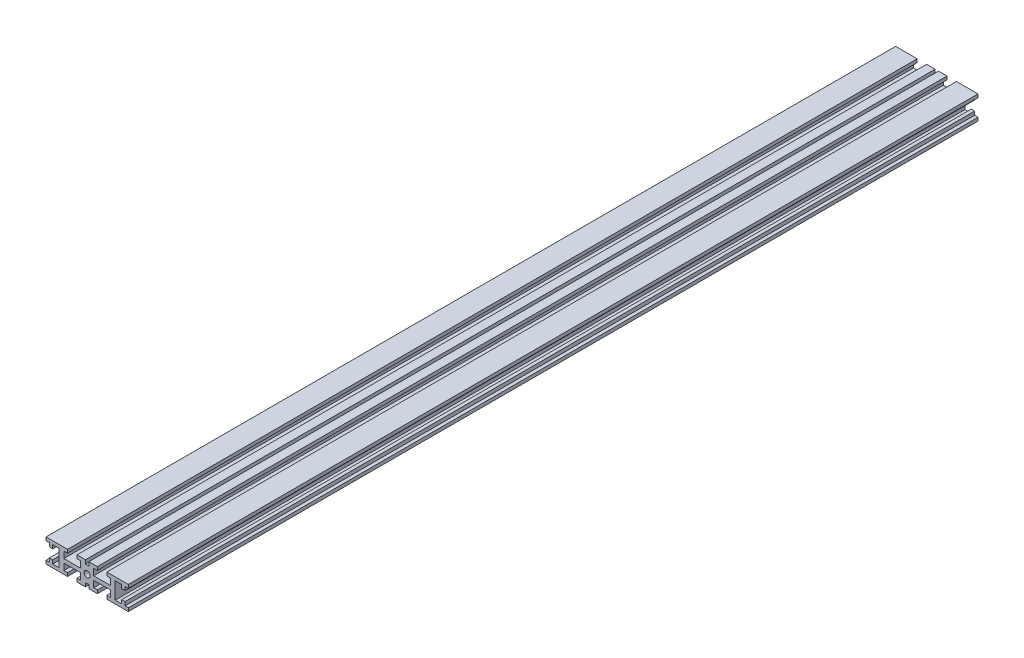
SolidWorks part; units mm, degrees
ref_plane "Front Plane" through (0, 0, 0) normal (0, 0, 1) x (1, 0, 0)
ref_plane "Top Plane" through (0, 0, 0) normal (0, 1, 0) x (1, 0, 0)
ref_plane "Right Plane" through (0, 0, 0) normal (1, 0, 0) x (0, 0, -1)
sketch "Sketch1" plane through (0, 0, 0) normal (0, 0, 1) x (1, 0, 0)
  line L0 (5.5, 6.35) -> (-5.5, 6.35)
  line L1 (-10.6, 6.35) -> (-22.225, 6.35)
  line L2 (-5.5, -6.35) -> (5.5, -6.35)
  line L3 (-3.5, 1.05) -> (-12.6, 1.05)
  line L4 (-20.425, 2.55) -> (-20.425, 4.55)
  line L5 (-3.5, -1.05) -> (-12.6, -1.05)
  line L6 (0, -6.35) -> (0, 6.35) construction
  line L7 (3.5, 4.55) -> (3.5, 1.05)
  line L8 (12.6, 1.05) -> (12.6, 4.55)
  line L9 (5.5, -4.55) -> (3.5, -4.55)
  line L10 (22.225, -6.35) -> (10.6, -6.35)
  line L11 (-12.6, 4.55) -> (-10.6, 4.55)
  line L12 (12.6, -1.05) -> (12.6, -4.55)
  line L13 (-10.6, 4.55) -> (-10.6, 6.35)
  line L14 (5.5, -4.55) -> (5.5, -6.35)
  line L15 (-15.125, 4.55) -> (-18.625, 4.55)
  line L16 (10.6, -4.55) -> (10.6, -6.35)
  line L17 (3.5, -4.55) -> (3.5, -1.05)
  line L18 (12.6, -4.55) -> (10.6, -4.55)
  line L19 (20.425, -2.55) -> (20.425, -4.55)
  line L20 (18.625, 2.55) -> (20.425, 2.55)
  line L21 (-3.5, 4.55) -> (-5.5, 4.55)
  line L22 (18.625, -2.55) -> (20.425, -2.55)
  line L23 (-5.5, 4.55) -> (-5.5, 6.35)
  line L24 (15.125, 4.55) -> (15.125, -4.55)
  line L25 (18.625, -4.55) -> (15.125, -4.55)
  line L26 (18.625, -4.55) -> (18.625, -2.55)
  line L27 (18.625, 4.55) -> (18.625, 2.55)
  line L28 (5.5, 4.55) -> (5.5, 6.35)
  line L29 (3.5, 4.55) -> (5.5, 4.55)
  line L30 (15.125, 4.55) -> (18.625, 4.55)
  line L31 (-18.625, 4.55) -> (-18.625, 2.55)
  line L32 (-18.625, -4.55) -> (-18.625, -2.55)
  line L33 (-18.625, -4.55) -> (-15.125, -4.55)
  line L34 (-15.125, 4.55) -> (-15.125, -4.55)
  line L35 (-18.625, -2.55) -> (-20.425, -2.55)
  line L36 (-18.625, 2.55) -> (-20.425, 2.55)
  line L37 (10.6, 4.55) -> (10.6, 6.35)
  line L38 (-20.425, 4.55) -> (-22.225, 4.55)
  line L39 (12.6, 4.55) -> (10.6, 4.55)
  line L40 (3.5, -1.05) -> (12.6, -1.05)
  line L41 (-12.6, -4.55) -> (-10.6, -4.55)
  line L42 (20.425, -4.55) -> (22.225, -4.55)
  line L43 (3.5, 1.05) -> (12.6, 1.05)
  line L44 (10.6, 6.35) -> (22.225, 6.35)
  line L45 (-22.225, -6.35) -> (-22.225, -4.55)
  line L46 (-3.5, -4.55) -> (-3.5, -1.05)
  line L47 (-22.225, 6.35) -> (-22.225, 4.55)
  line L48 (-10.6, -4.55) -> (-10.6, -6.35)
  line L49 (-20.425, -2.55) -> (-20.425, -4.55)
  line L50 (-5.5, -4.55) -> (-5.5, -6.35)
  line L51 (-20.425, -4.55) -> (-22.225, -4.55)
  line L52 (22.225, -4.55) -> (22.225, -6.35)
  line L53 (20.425, 2.55) -> (20.425, 4.55)
  line L54 (20.425, 4.55) -> (22.225, 4.55)
  line L55 (-12.6, -1.05) -> (-12.6, -4.55)
  line L56 (22.225, 4.55) -> (22.225, 6.35)
  line L57 (-22.225, -6.35) -> (-10.6, -6.35)
  line L59 (-5.5, -4.55) -> (-3.5, -4.55)
  line L63 (-12.6, 1.05) -> (-12.6, 4.55)
  line L65 (-3.5, 4.55) -> (-3.5, 1.05)
  point P14 (-5.5, -5.45)
  point P15 (-10.6, -5.45)
  dimension "D11" = 6.35
  dimension "D16" = 2
  dimension "D6" = 12.7
  dimension "D8" = 5.5
  dimension "D5" = 1.8
  dimension "D7" = 5.1
  dimension "D9" = 5.5
  dimension "D10" = 3.5
  dimension "D12" = 2
  dimension "D13" = 1.8
  dimension "D14" = 44.45
  dimension "D15" = 1.8
  dimension "D17" = 3.5
  dimension "D18" = 1.8
  dimension "D19" = 2
  dimension "D20" = 1.8
  dimension "D22" = 2
  dimension "D23" = 1.8
  dimension "D26" = 2
  dimension "D27" = 2
  dimension "D29" = 3.5
  dimension "D33" = 9.1
  dimension "D41" = 1.8
extrude "Boss-Extrude1" add sketch "Sketch1" along normal blind 458.6
sketch "Sketch2" plane through (0, 0, 458.6) normal (0, 0, 1) x (1, 0, 0)
  circle A1 centre (0, 0) radius 2
  dimension "D3" = 4
hole_wizard "M4 Tapped Hole1" positions "3DSketch1" profile "Sketch3" tap size "M4" standard "DIN"
sketch3d "3DSketch1"
  point P0 (0, 0, 458.6)
sketch "Sketch3" plane through (0, 0, 458.6) normal (1, 0, 0) x (0, -1, 0)
  line L0 (0, 0) -> (0, 458.6)
  line L1 (0, 458.6) -> (1.65, 458.6)
  line L2 (1.65, 458.6) -> (1.65, 0)
  line L5 (1.65, 0) -> (0, 0)
  line L11 (0, -6.35) -> (0, 107.95) construction
  dimension "Thru Tap Drill Dia." = 3.3
  dimension "Thru Tap Drill Depth" = 458.6
sketch "Sketch5" plane through (0, 0, 458.6) normal (0, 0, 1) x (1, 0, 0)
  line L2 (-0.9, -6.35) -> (0.9, -6.35)
  line L3 (-0.9, -6.35) -> (-0.9, -4.35)
  line L4 (-0.9, -4.35) -> (0.9, -4.35)
  line L5 (0.9, -6.35) -> (0.9, -4.35)
  line L6 (0.9, 6.35) -> (-0.9, 6.35)
  line L7 (0.9, 6.35) -> (0.9, 4.35)
  line L8 (0.9, 4.35) -> (-0.9, 4.35)
  line L9 (-0.9, 6.35) -> (-0.9, 4.35)
  line L11 (-5.5, -6.35) -> (5.5, -6.35) construction
  line L22 (5.5, 6.35) -> (-5.5, 6.35) construction
  point P4 (0, 4.35)
  dimension "D1" = 1.8
  dimension "D2" = 2
  dimension "D3" = 2
  dimension "D6" = 1.8
extrude "Cut-Extrude1" cut sketch "Sketch5" against normal through all
